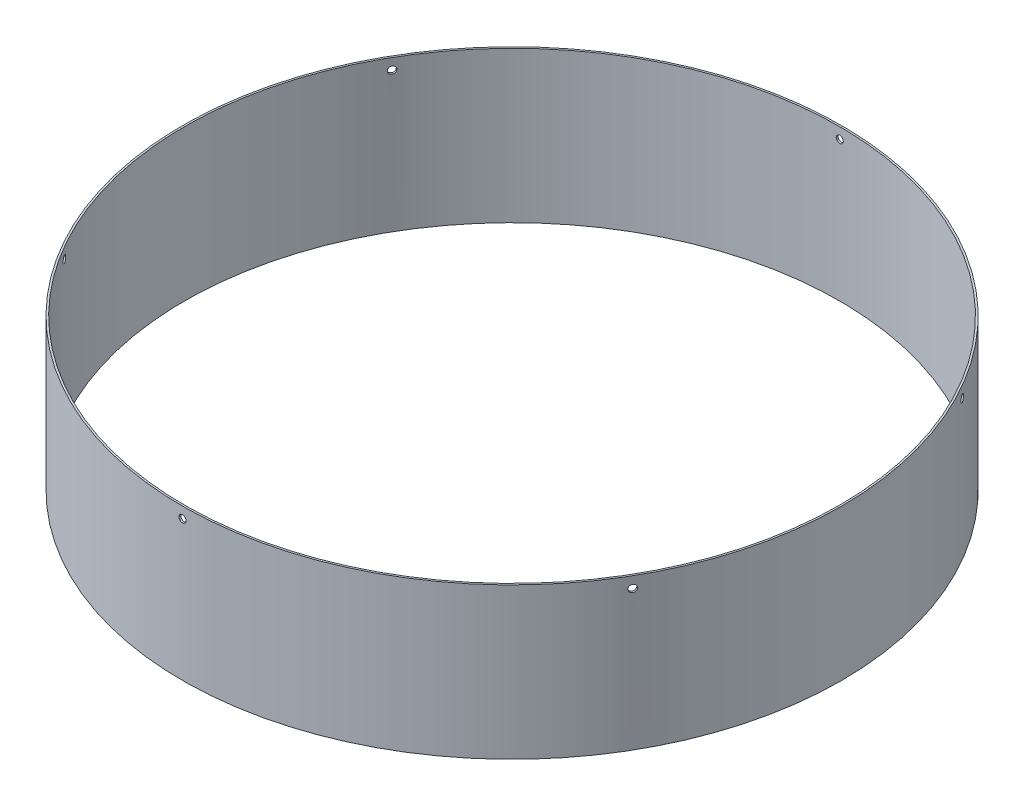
SolidWorks part; units mm, degrees
ref_plane "Front Plane" through (0, 0, 0) normal (0, 0, 1) x (1, 0, 0)
ref_plane "Top Plane" through (0, 0, 0) normal (0, 1, 0) x (1, 0, 0)
ref_plane "Right Plane" through (0, 0, 0) normal (1, 0, 0) x (0, 0, -1)
sketch "Sketch1" plane through (0, 0, 0) normal (0, 1, 0) x (1, 0, 0)
  circle A0 centre (0, 0) radius 152.4127
  circle A1 centre (0, 0) radius 151.5491
  dimension "D1" = 303.0982
  dimension "D2" = 0.8636
extrude "Extrude1" add sketch "Sketch1" along normal blind 69.85 contours A0 | A1
sketch "Sketch2" plane through (0, 0, 0) normal (0, 0, 1) x (1, 0, 0)
  line L0 (152.4127, 69.85) -> (-152.4127, 69.85) construction
  circle A0 centre (0, 64.77) radius 1.6319
  dimension "D1" = 5.08
  dimension "D2" = 3.2639
extrude "Cut-Extrude1" cut sketch "Sketch2" against normal through all
ref_axis "Axis1" through (0, 69.85, 0) along (0, -1, 0)
pattern_circular "CirPattern1" count 6 over 360 about axis through (0, 69.85, 0) along (0, -1, 0) of "Cut-Extrude1"
sketch "Sketch3" plane through (0, 69.85, 0) normal (0, 1, 0) x (-1, 0, 0)
  line L1 (0, 0) -> (-163.7423, 0)
  line L2 (0, 0) -> (0, 0.0025)
  line L3 (0, 0.0025) -> (-163.7423, 0.0025)
  line L4 (-163.7423, 0) -> (-163.7423, 0.0025)
  dimension "D1" = 0.0025
extrude "Cut-Extrude2" cut sketch "Sketch3" against normal through all
